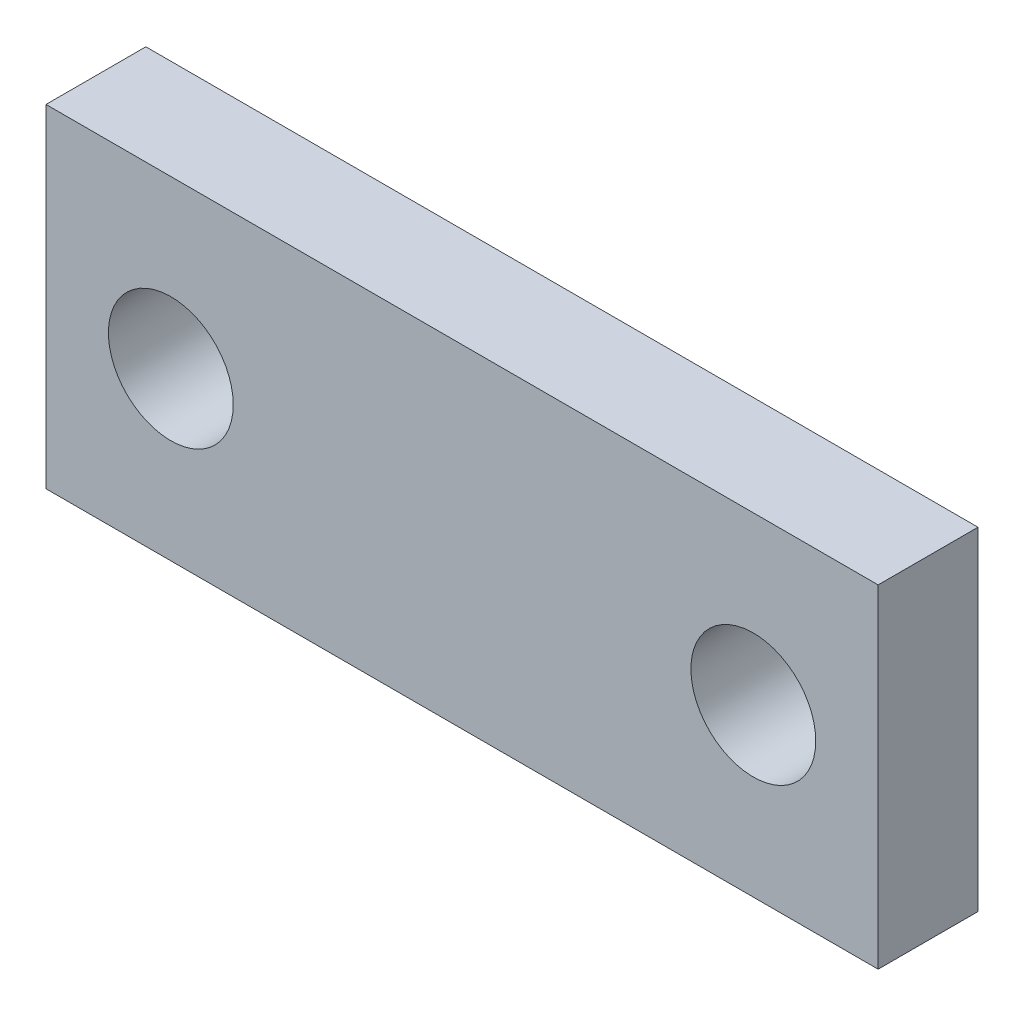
SolidWorks part; units mm, degrees
ref_plane "Front Plane" through (0, 0, 0) normal (0, 0, 1) x (1, 0, 0)
ref_plane "Top Plane" through (0, 0, 0) normal (0, 1, 0) x (1, 0, 0)
ref_plane "Right Plane" through (0, 0, 0) normal (1, 0, 0) x (0, 0, -1)
sketch "Sketch1" plane through (0, 0, 0) normal (0, 0, 1) x (1, 0, 0)
  line L1 (-19.9221, 3.2795) -> (11.8279, 3.2795)
  line L2 (-19.9221, 3.2795) -> (-19.9221, -9.4205)
  line L3 (-19.9221, -9.4205) -> (11.8279, -9.4205)
  line L4 (11.8279, 3.2795) -> (11.8279, -9.4205)
  dimension "D1" = 31.75
  dimension "D2" = 12.7
extrude "Extrude2" add sketch "Sketch1" along normal blind 3.81
sketch "Sketch3" plane through (0, 0, 3.81) normal (0, 0, 1) x (1, 0, 0)
  line L0 (-22.669, -3.0705) -> (17.4607, -3.0705) construction
  line L1 (-4.0471, 8.5706) -> (-4.0471, -16.1936) construction
  line L2 (-11.1909, 9.0386) -> (-11.1909, -14.2437) construction
  line L3 (11.8279, 3.2795) -> (-19.9221, 3.2795) construction
  line L4 (11.8279, -9.4205) -> (11.8279, 3.2795) construction
  circle A0 centre (-15.1596, -3.0705) radius 2.3813
  circle A1 centre (7.0654, -3.0705) radius 2.3813
  dimension "D4" = 3.9688
  dimension "D5" = 4.7625
  dimension "D1" = 6.35
  dimension "D2" = 15.875
  dimension "D3" = 7.1437
extrude "Cut-Extrude1" cut sketch "Sketch3" against normal blind 3.81
